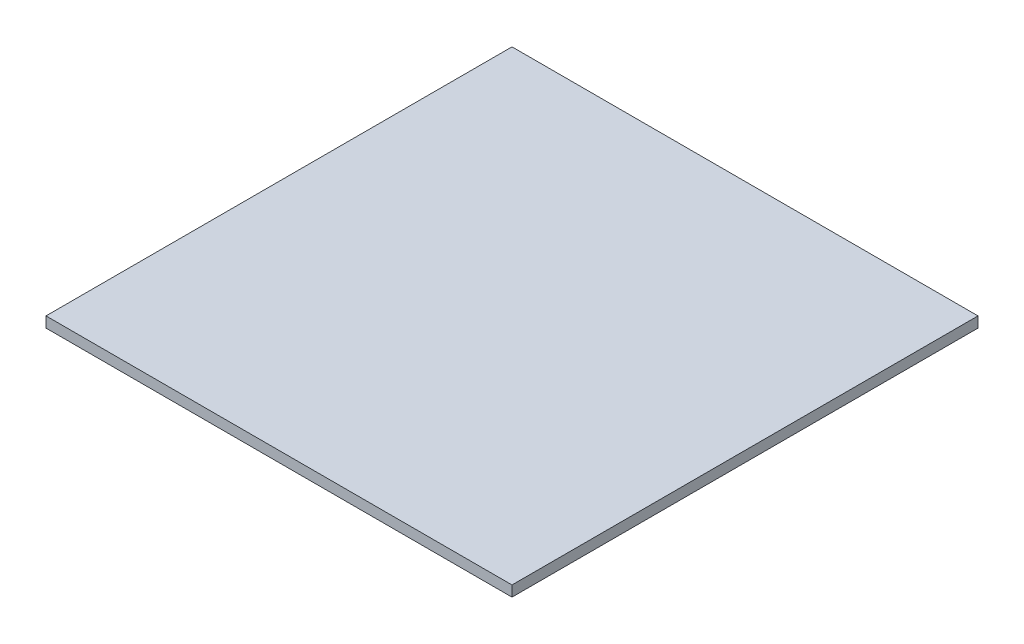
SolidWorks part; units mm, degrees
ref_plane "Front Plane" through (0, 0, 0) normal (0, 0, 1) x (1, 0, 0)
ref_plane "Top Plane" through (0, 0, 0) normal (0, 1, 0) x (1, 0, 0)
ref_plane "Right Plane" through (0, 0, 0) normal (1, 0, 0) x (0, 0, -1)
sketch "Sketch1" plane through (0, 0, 0) normal (0, 1, 0) x (1, 0, 0)
  line L0 (-50.6753, 48.6342) -> (-48.1353, 51.1742)
  line L1 (-48.1353, -50.4258) -> (48.3847, -50.4258)
  line L2 (-50.6753, -47.8858) -> (-50.6753, 48.6342)
  line L3 (-48.1353, 51.1742) -> (48.3847, 51.1742)
  line L4 (50.9247, -47.8858) -> (50.9247, 48.6342)
  line L5 (-50.6753, -50.4258) -> (50.9247, 51.1742) construction
  line L6 (-50.6753, 51.1742) -> (50.9247, -50.4258) construction
  line L7 (48.3847, 51.1742) -> (50.9247, 48.6342)
  line L8 (48.3847, -50.4258) -> (50.9247, -47.8858)
  line L9 (-50.6753, -47.8858) -> (-48.1353, -50.4258)
  line L10 (-41.1503, 41.6492) -> (0.1247, 41.6492)
  line L11 (41.3997, -40.9008) -> (-41.1503, -40.9008) construction
  line L12 (41.3997, -40.9008) -> (41.3997, 41.6492) construction
  line L13 (41.3997, 41.6492) -> (-41.1503, 41.6492) construction
  line L14 (-41.1503, -40.9008) -> (-41.1503, 41.6492) construction
  line L15 (41.3997, -40.9008) -> (-41.1503, 41.6492) construction
  line L16 (41.3997, 41.6492) -> (-41.1503, -40.9008) construction
  line L17 (41.3997, -40.9008) -> (0.1247, -40.9008)
  line L18 (-34.8003, -34.5508) -> (35.0497, -34.5508)
  line L19 (-34.8003, -34.5508) -> (-34.8003, 35.2992)
  line L20 (-34.8003, 35.2992) -> (35.0497, 35.2992)
  line L21 (35.0497, -34.5508) -> (35.0497, 35.2992)
  line L22 (-34.8003, -34.5508) -> (35.0497, 35.2992) construction
  line L23 (-34.8003, 35.2992) -> (35.0497, -34.5508) construction
  circle A0 centre (-41.1503, 41.6492) radius 3.2639
  circle A1 centre (0.1247, 41.6492) radius 3.2639
  circle A2 centre (41.3997, 41.6492) radius 3.2639
  circle A3 centre (41.3997, 0.3742) radius 3.2639
  circle A4 centre (41.3997, -40.9008) radius 3.2639
  circle A5 centre (0.1247, -40.9008) radius 3.2639
  circle A6 centre (-41.1503, -40.9008) radius 3.2639
  circle A7 centre (-41.1503, 0.3742) radius 3.2639
  circle A8 centre (-20.5128, 41.6492) radius 4.7625
  circle A9 centre (20.7622, -40.9008) radius 4.7625
  point P0 (0.1247, 0.3742)
  point P13 (0.1247, 0.3742)
  point P34 (0.1247, 0.3742)
  dimension "D13" = 6.5278
  dimension "D14" = 9.525
  dimension "D1" = 101.6
  dimension "D2" = 101.6
  dimension "D3" = 2.54
  dimension "D4" = 2.54
  dimension "D5" = 2.54
  dimension "D6" = 2.54
  dimension "D7" = 2.54
  dimension "D8" = 2.54
  dimension "D9" = 2.54
  dimension "D10" = 2.54
  dimension "D11" = 82.55
  dimension "D12" = 82.55
  dimension "D15" = 69.85
  dimension "D16" = 69.85
extrude "Boss-Extrude1" add sketch "Sketch1" along normal blind 1.5875 contours L18 L21 L20 L19
